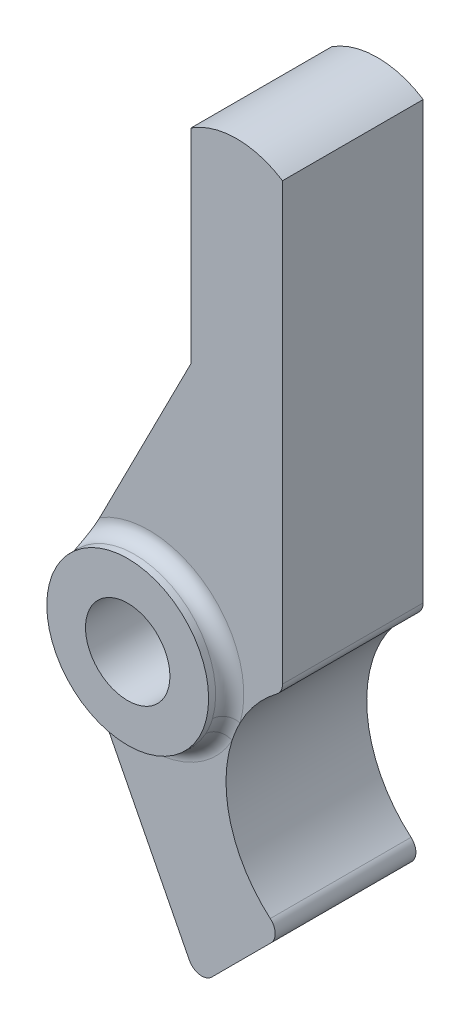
SolidWorks part; units mm, degrees
ref_plane "Plan1" through (0, 0, 0) normal (0, 0, 1) x (1, 0, 0)
ref_plane "Plan2" through (0, 0, 0) normal (0, 1, 0) x (1, 0, 0)
ref_plane "Plan3" through (0, 0, 0) normal (1, 0, 0) x (0, 0, -1)
sketch "Esquisse1" plane through (0, 0, 0) normal (0, 0, 1) x (1, 0, 0)
  line L0 (0, 0) -> (0, 63)
  line L2 (-13, 63) -> (-13, 34)
  line L3 (0, -30) -> (-12, -42)
  line L4 (-12, -42) -> (-28.8153, -8.9925)
  line L5 (-13, 34) -> (-28.7695, 3.0669)
  arc A0 (-28.7695, 3.0669) -> (-28.8153, -8.9925) centre (-19, -3) ccw
  arc A1 (0, 0) -> (0, -30) centre (10, -15) ccw
  arc A2 (0, 63) -> (-13, 63) centre (-6.5, 53) ccw
  point P7 (-19, -3)
  dimension "D9" = 23
  dimension "D1" = 13
  dimension "D2" = 63
  dimension "D3" = 29
  dimension "D6" = 225
  dimension "D7" = 6
  dimension "D10" = 15
  dimension "D11" = 6.5
extrude "Base-Extrusion" add sketch "Esquisse1" along normal blind 20
fillet "Congé2" radius 2
fillet "Congé3" radius 2
sketch "Esquisse2" plane through (0, 0, 20) normal (0, 0, 1) x (1, 0, 0)
  circle A0 centre (-19, -3) radius 11.5
extrude "Boss.-Extru.1" add sketch "Esquisse2" along normal blind 3
sketch "Esquisse3" plane through (0, 0, 0) normal (0, 0, -1) x (-1, 0, 0)
  circle A0 centre (19, -3) radius 11.5
extrude "Boss.-Extru.2" add sketch "Esquisse3" along normal blind 3
fillet "Congé6" radius 2
sketch "Esquisse4" plane through (0, 0, 23) normal (0, 0, 1) x (1, 0, 0)
  circle A0 centre (-19, -3) radius 6
  dimension "D1" = 12
extrude "Enlèv. mat.-Extru.1" cut sketch "Esquisse4" against normal through all
